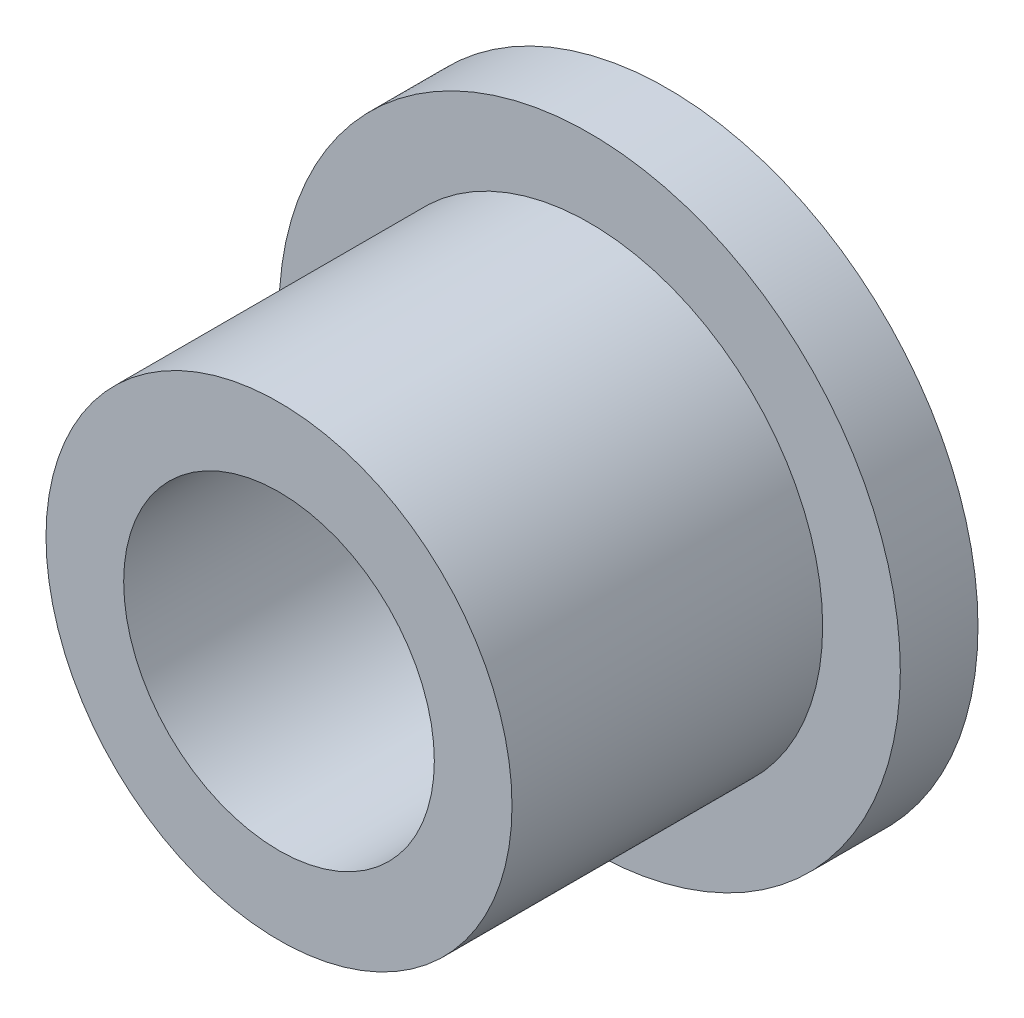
SolidWorks part; units mm, degrees
ref_plane "Alzado" through (0, 0, 0) normal (0, 0, 1) x (1, 0, 0)
ref_plane "Planta" through (0, 0, 0) normal (0, 1, 0) x (1, 0, 0)
ref_plane "Vista lateral" through (0, 0, 0) normal (1, 0, 0) x (0, 0, -1)
sketch "Croquis1" plane through (0, 0, 0) normal (0, 0, 1) x (1, 0, 0)
  circle A0 centre (0, 0) radius 8
extrude "Extruir1" add sketch "Croquis1" along normal blind 2
sketch "Croquis2" plane through (0, 0, 2) normal (0, 0, 1) x (1, 0, 0)
  circle A0 centre (0, 0) radius 6
extrude "Extruir2" add sketch "Croquis2" along normal blind 8
sketch "Croquis3" plane through (0, 0, 10) normal (0, 0, 1) x (1, 0, 0)
  point P0 (0, 0)
hole_wizard "Taladro de diámetro de Ø8.0 (8)1" positions "Croquis3D1" profile "Croquis4" hole size "Ø8.0" standard "ISO"
sketch3d "Croquis3D1"
  point P0 (0, 0, 10)
sketch "Croquis4" plane through (0, 0, 10) normal (1, 0, 0) x (0, -1, 0)
  line L0 (0, 0) -> (0, 10)
  line L1 (0, 10) -> (4, 10)
  line L2 (4, 10) -> (4, 0)
  line L5 (4, 0) -> (0, 0)
  line L11 (0, -6.35) -> (0, 107.95) construction
  dimension "Diámetro de taladro hasta el siguiente" = 8
  dimension "Profundidad de taladro hasta el siguiente" = 10
